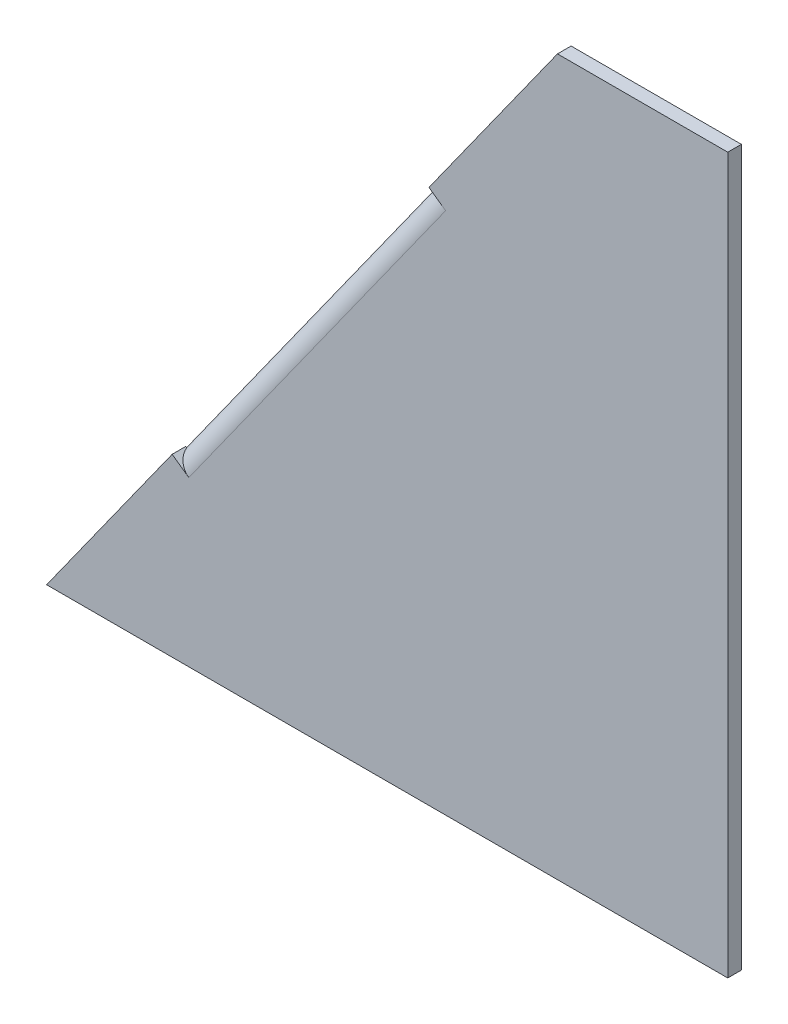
SolidWorks part; units mm, degrees
ref_plane "Ebene vorne" through (0, 0, 0) normal (0, 0, 1) x (1, 0, 0)
ref_plane "Ebene oben" through (0, 0, 0) normal (0, 1, 0) x (1, 0, 0)
ref_plane "Ebene rechts" through (0, 0, 0) normal (1, 0, 0) x (0, 0, -1)
sketch "Skizze1" plane through (0, 0, 0) normal (0, 0, 1) x (1, 0, 0)
  line L0 (-100, 0) -> (0, 0)
  line L1 (0, 0) -> (0, 105)
  line L2 (0, 105) -> (-25, 105)
  line L3 (-25, 105) -> (-100, 0)
  dimension "D1" = 100
  dimension "D2" = 105
  dimension "D3" = 25
sheet metal parameters "Blech1" thickness 2 parameters "D1"=2, "Dicke"=2
base flange "Basis-Blech1" sketch "Skizze1" thickness 2 reverse thickness direction no parameters "D1"=2
hem "Blechkantenrand1" parameters "D1"=1, "D7"=10, "D8"=2, "D9"=1
sketch "Skizze4" plane through (-100, 0, -2) normal (0, 0, -1) x (0.5812, 0.8137, 0)
  line L0 (129.0349, 0) -> (0, 0) construction
  line L1 (96.5822, 0) -> (31.7129, 0)
bend "Blechkantenrand-Biegung1" bend radius 1 bend angle 180 parameters "D5"=1
flat pattern "Abwicklung1"
sketch "Biegung-Linien1" plane through (0, 0, 0) normal (0, 1, 0) x (-1, 0, 0)
bend of the flat pattern "Abwickeln-<Blechkantenrand-Biegung1>1"
